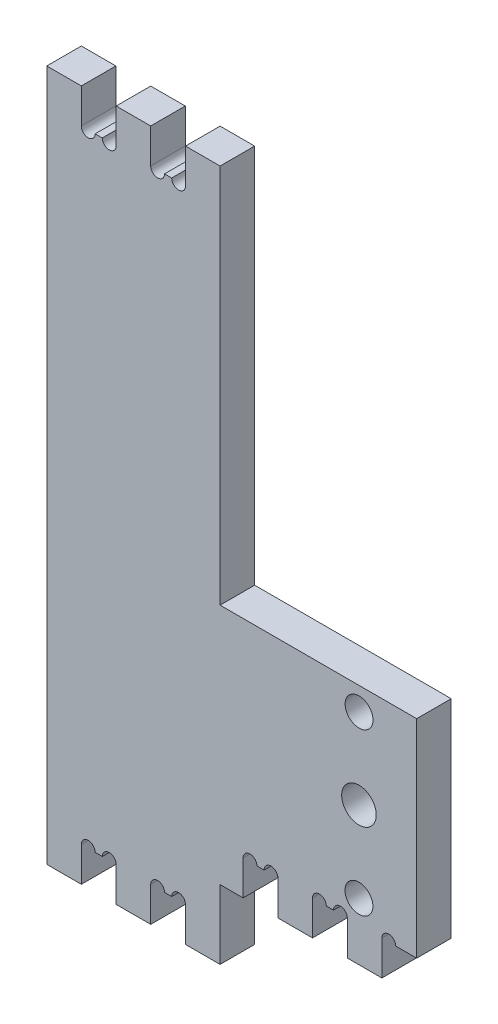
SolidWorks part; units mm, degrees
ref_plane "Ebene vorne" through (0, 0, 0) normal (0, 0, 1) x (1, 0, 0)
ref_plane "Ebene oben" through (0, 0, 0) normal (0, 1, 0) x (1, 0, 0)
ref_plane "Ebene rechts" through (0, 0, 0) normal (1, 0, 0) x (0, 0, -1)
sketch "Skizze1" plane through (0, 0, 0) normal (0, 0, 1) x (1, 0, 0)
  line L0 (14.7482, -15) -> (14.7482, -40)
  line L1 (100.0482, 90) -> (100.0482, 0)
  line L2 (14.7482, -40) -> (14.7482, -45)
  line L3 (14.7482, 90) -> (100.0482, 90)
  line L5 (-60.4518, -40) -> (-60.4518, 160)
  line L6 (14.7482, 240) -> (14.7482, 90)
  line L8 (14.7482, -45) -> (-0.2518, -45)
  line L9 (-0.2518, -45) -> (-0.2518, -30)
  line L10 (-6.2518, -30) -> (-9.3518, -30)
  line L11 (-15.3518, -30) -> (-15.3518, -45)
  line L12 (-15.3518, -45) -> (-30.3518, -45)
  line L13 (-30.3518, -45) -> (-30.3518, -30)
  line L14 (-36.3518, -30) -> (-39.4518, -30)
  line L15 (-45.4518, -30) -> (-45.4518, -45)
  line L16 (100.0482, 0) -> (90.9482, 0)
  line L17 (84.9482, 0) -> (84.9482, -15)
  line L18 (84.9482, -15) -> (69.9482, -15)
  line L19 (69.9482, -15) -> (69.9482, 0)
  line L20 (63.9482, 0) -> (60.8482, 0)
  line L21 (54.8482, 0) -> (54.8482, -15)
  line L22 (54.8482, -15) -> (39.8482, -15)
  line L23 (39.8482, -15) -> (39.8482, 0)
  line L24 (33.8482, 0) -> (30.7482, 0)
  line L25 (24.7482, 0) -> (24.7482, -15)
  line L26 (24.7482, -15) -> (14.7482, -15)
  line L27 (-45.4518, -45) -> (-60.4518, -45)
  line L29 (-60.4518, -45) -> (-60.4518, -40)
  line L30 (-60.4518, 160) -> (-60.4518, 255)
  line L31 (-60.4518, 255) -> (-45.4518, 255)
  line L32 (-45.4518, 255) -> (-45.4518, 240)
  line L33 (-39.4518, 240) -> (-36.3518, 240)
  line L34 (-30.3518, 240) -> (-30.3518, 255)
  line L35 (-30.3518, 255) -> (-15.3518, 255)
  line L36 (-15.3518, 255) -> (-15.3518, 240)
  line L37 (-9.3518, 240) -> (-6.2518, 240)
  line L38 (-0.2518, 240) -> (-0.2518, 255)
  line L39 (-0.2518, 255) -> (14.7482, 255)
  line L40 (14.7482, 255) -> (14.7482, 240)
  arc A0 (-45.4518, -30) -> (-39.4518, -30) centre (-42.4518, -30) cw
  arc A1 (-36.3518, -30) -> (-30.3518, -30) centre (-33.3518, -30) cw
  arc A2 (-15.3518, -30) -> (-9.3518, -30) centre (-12.3518, -30) cw
  arc A3 (-6.2518, -30) -> (-0.2518, -30) centre (-3.2518, -30) cw
  arc A4 (-45.4518, 240) -> (-39.4518, 240) centre (-42.4518, 240) ccw
  arc A5 (-36.3518, 240) -> (-30.3518, 240) centre (-33.3518, 240) ccw
  arc A6 (90.9482, 0) -> (84.9482, 0) centre (87.9482, 0) ccw
  arc A7 (54.8482, 0) -> (60.8482, 0) centre (57.8482, 0) cw
  arc A8 (63.9482, 0) -> (69.9482, 0) centre (66.9482, 0) cw
  arc A9 (24.7482, 0) -> (30.7482, 0) centre (27.7482, 0) cw
  arc A10 (33.8482, 0) -> (39.8482, 0) centre (36.8482, 0) cw
  arc A11 (-15.3518, 240) -> (-9.3518, 240) centre (-12.3518, 240) ccw
  arc A12 (-6.2518, 240) -> (-0.2518, 240) centre (-3.2518, 240) ccw
  dimension "D13" = 3
  dimension "D14" = 3
  dimension "D15" = 3
  dimension "D16" = 3
  dimension "D17" = 3
  dimension "D18" = 3
  dimension "D3" = 10
  dimension "D9" = 15
  dimension "D10" = 15.1
  dimension "D6" = 3
  dimension "D26" = 3
  dimension "D19" = 3
  dimension "D20" = 3
  dimension "D5" = 3
  dimension "D27" = 3
  dimension "D28" = 3
  dimension "D4" = 25
  dimension "D7" = 15.1
  dimension "D8" = 15
  dimension "D11" = 300
  dimension "D12" = 15
  dimension "D21" = 15.1
  dimension "D22" = 15
  dimension "D23" = 15.1
  dimension "D24" = 15
  dimension "D25" = 15.1
  dimension "D29" = 15
  dimension "D30" = 15.1
  dimension "D31" = 15
  dimension "D32" = 15.1
  dimension "D33" = 15
  dimension "D34" = 90
  dimension "D35" = 15
  dimension "D36" = 15
  dimension "D37" = 15
  dimension "D38" = 15
  dimension "D39" = 15
  dimension "D40" = 15
  dimension "D41" = 150
  dimension "D42" = 15
  dimension "D43" = 15
  dimension "D44" = 15
  dimension "D45" = 15
  dimension "D46" = 15
  dimension "D47" = 15
extrude "outline" add sketch "Skizze1" along normal blind 15
sketch "Skizze2" plane through (0, 0, 15) normal (0, 0, 1) x (1, 0, 0)
  line L2 (100.0482, 90) -> (14.7482, 90) construction
  line L4 (100.0482, 0) -> (100.0482, 90) construction
  circle A0 centre (75.0482, 80) radius 6.05
  circle A31 centre (75, 45) radius 7.5
  circle A32 centre (75, 10) radius 6.05
  dimension "D38" = 15
  dimension "D39" = 12.1
  dimension "D6" = 12.1
  dimension "D1" = 35
  dimension "D2" = 25
  dimension "D7" = 70
  dimension "D8" = 10
extrude "inner" cut sketch "Skizze2" against normal blind 15 contours A0
equation "\"R3\"=1.76067"
